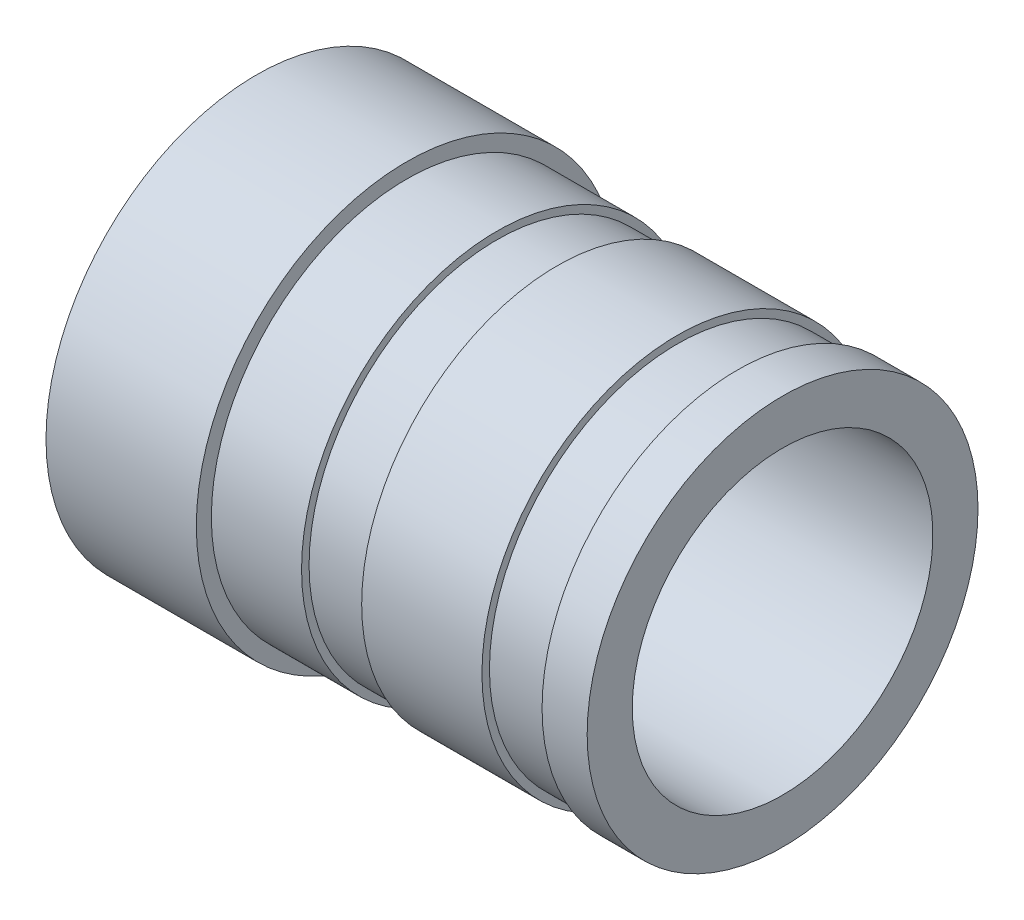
SolidWorks part; units mm, degrees
ref_plane "Face" through (0, 0, 0) normal (0, 0, 1) x (1, 0, 0)
ref_plane "Dessus" through (0, 0, 0) normal (0, 1, 0) x (1, 0, 0)
ref_plane "Droite" through (0, 0, 0) normal (1, 0, 0) x (0, 0, -1)
sketch "Esquisse1" plane through (0, 0, 0) normal (0, 0, 1) x (1, 0, 0)
  line L0 (0, 0) -> (111.0436, 0) construction
  line L1 (35, 10) -> (15.8, 10)
  line L2 (0, 0) -> (15.8, 0)
  line L3 (0, 0) -> (0, 14)
  line L5 (35, 10) -> (35, 13)
  line L6 (0, 14) -> (10, 14)
  line L7 (15.8, 10) -> (15.8, 0)
  line L10 (35, 13) -> (10, 13)
  line L11 (10, 14) -> (10, 13)
  dimension "D1" = 14
  dimension "D2" = 25
  dimension "D3" = 20
  dimension "D4" = 10
  dimension "D5" = 19.2
  dimension "D6" = 26
revolve "Base-Révolution" add sketch "Esquisse1" angle 360 about L0
sketch "Esquisse3" plane through (0, 0, 0) normal (0, 0, 1) x (1, 0, 0)
  line L0 (35, 13) -> (10, 13) construction
  line L1 (16, 27.8989) -> (20, 27.8989)
  line L2 (16, 27.8989) -> (16, 12.5)
  line L3 (16, 12.5) -> (20, 12.5)
  line L4 (20, 27.8989) -> (20, 12.5)
  line L5 (28, 30.1998) -> (32, 30.1998)
  line L6 (28, 30.1998) -> (28, 12.5)
  line L7 (28, 12.5) -> (32, 12.5)
  line L8 (32, 30.1998) -> (32, 12.5)
  line L9 (35, -13) -> (35, 13) construction
  line L10 (0, 0) -> (42.8592, 0) construction
  dimension "D1" = 0.5
  dimension "D2" = 3
  dimension "D3" = 8
  dimension "D4" = 4
revolve "Enlèvement de matière-Révolution1" cut sketch "Esquisse3" angle 360 about L10
sketch "Esquisse4" plane through (0, 0, 0) normal (-1, 0, 0) x (0, 0, 1)
  circle A0 centre (0, 0) radius 5
  dimension "D1" = 10
extrude "Enlèv. mat.-Extru.1" cut sketch "Esquisse4" against normal through all
